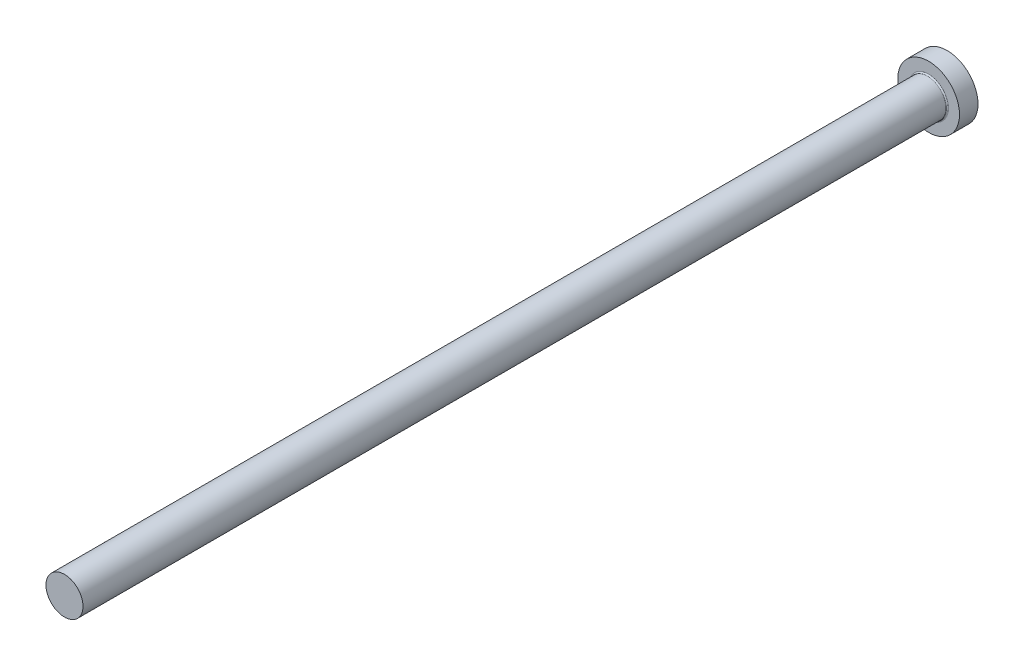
SolidWorks part; units mm, degrees
ref_plane "Plan de face" through (0, 0, 0) normal (0, 0, 1) x (1, 0, 0)
ref_plane "Plan de dessus" through (0, 0, 0) normal (0, 1, 0) x (1, 0, 0)
ref_plane "Plan de droite" through (0, 0, 0) normal (1, 0, 0) x (0, 0, -1)
imported_body "Importée1"
sketch "Esquisse1" plane through (0, 0, 0.0004) normal (0, 0, 1) x (1, 0, 0)
  circle A0 centre (-12.4055, -42.687) radius 3
  dimension "D1" = 6
extrude "Extrusion1" add sketch "Esquisse1" against normal up to surface (140.0004 mm away)
fillet "Congé1" radius 0.2 1 edges at (-9.4055, -42.687, -140)
